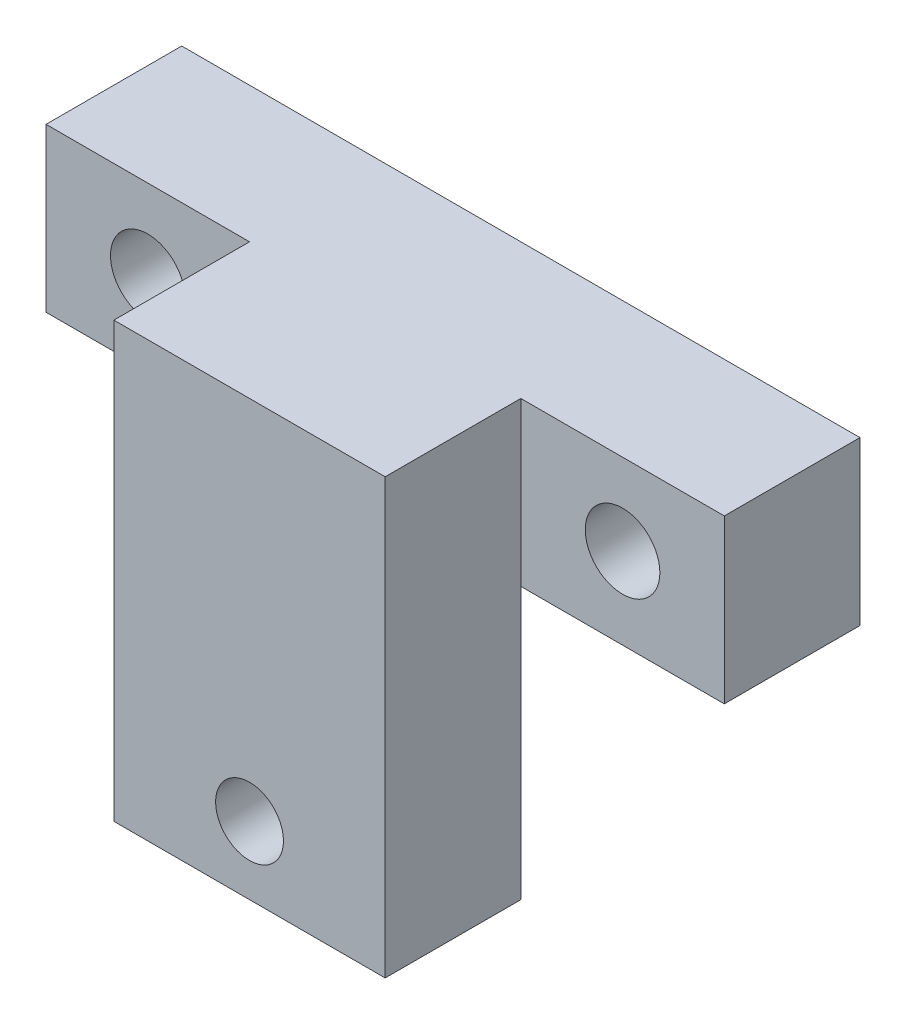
SolidWorks part; units mm, degrees
ref_plane "前视基准面" through (0, 0, 0) normal (0, 0, 1) x (1, 0, 0)
ref_plane "上视基准面" through (0, 0, 0) normal (0, 1, 0) x (1, 0, 0)
ref_plane "右视基准面" through (0, 0, 0) normal (1, 0, 0) x (0, 0, -1)
sketch "草图1" plane through (0, 0, 0) normal (0, 0, 1) x (1, 0, 0)
  line L0 (15, 0) -> (15, 20)
  line L1 (35, 0) -> (35, 20)
  line L2 (0, 20) -> (0, 32)
  line L3 (50, 20) -> (50, 32)
  line L4 (0, 32) -> (50, 32)
  line L5 (0, 20) -> (15, 20)
  line L6 (15, 0) -> (35, 0)
  line L7 (35, 20) -> (50, 20)
  circle A0 centre (7.5, 26) radius 2.75
  circle A1 centre (42.5, 26) radius 2.75
  circle A2 centre (25, 5) radius 2.5
extrude "凸台-拉伸1" add sketch "草图1" along normal blind 20
sketch "草图2" plane through (50, 0, 0) normal (1, 0, 0) x (0, 0, -1)
  line L0 (0, 20) -> (0, 32)
  line L1 (-10, 0) -> (-10, 20)
  line L2 (-20, 0) -> (-20, 32)
  line L3 (-20, 32) -> (0, 32)
  line L4 (-10, 20) -> (0, 20)
  line L5 (-20, 0) -> (-10, 0)
extrude "切除-拉伸1" cut sketch "草图2" against normal up to next flip side to cut
sketch "草图3" plane through (0, 32, 0) normal (0, 1, 0) x (1, 0, 0)
  line L0 (0, 0) -> (50, 0)
  line L1 (0, -10) -> (15, -10)
  line L2 (15, -20) -> (35, -20)
  line L3 (15, -20) -> (15, -10)
  line L4 (35, -20) -> (35, -10)
  line L5 (50, -10) -> (50, 0)
  line L6 (0, -10) -> (0, 0)
  line L7 (35, -10) -> (50, -10)
extrude "切除-拉伸2" cut sketch "草图3" against normal blind 20 flip side to cut
